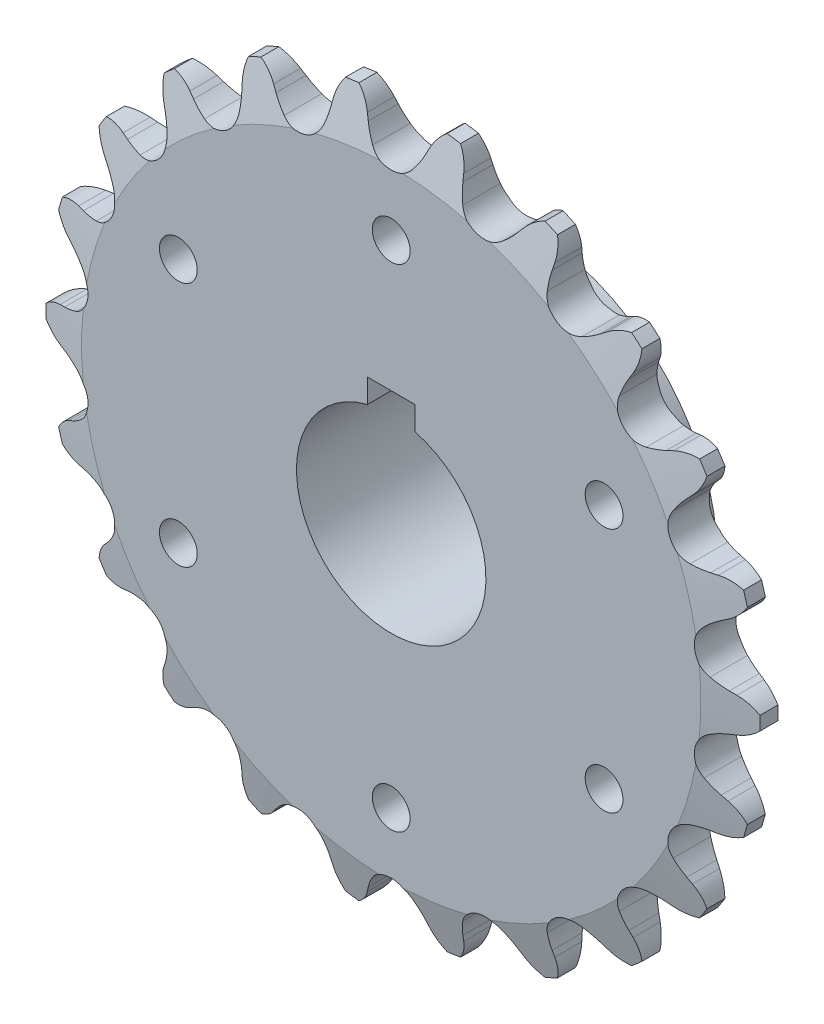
SolidWorks part; units mm, degrees
ref_plane "Front Plane" through (0, 0, 0) normal (0, 0, 1) x (1, 0, 0)
ref_plane "Top Plane" through (0, 0, 0) normal (0, 1, 0) x (1, 0, 0)
ref_plane "Right Plane" through (0, 0, 0) normal (1, 0, 0) x (0, 0, -1)
imported_body "Imported3"
sketch "Sketch1" plane through (0, 0, 0) normal (0, 0, -1) x (-1, 0, 0)
  circle A0 centre (0, 0) radius 12.7
extrude "Boss-Extrude1" add sketch "Sketch1" along normal blind 6.3817
sketch "Sketch2" plane through (0, 0, 2.794) normal (0, 0, 1) x (1, 0, 0)
  line L0 (1.59, 6.1608) -> (1.59, 7.7508)
  line L1 (1.59, 7.7508) -> (-1.59, 7.7508)
  line L2 (-1.59, 7.7508) -> (-1.59, 6.1608)
  arc A0 (-1.59, 6.1608) -> (1.59, 6.1608) centre (0, 0) cw
extrude "Cut-Extrude1" cut sketch "Sketch2" against normal through all
sketch "Sketch3" plane through (0, 0, 0) normal (0, 1, 0) x (1, 0, 0)
  line L0 (6.3627, 6.3818) -> (0, 6.3817)
  line L1 (0, 6.3817) -> (0, -2.794)
  line L2 (0, -2.794) -> (6.3627, -2.794)
  line L3 (6.3627, -2.794) -> (6.3627, 6.3818)
  line L4 (0, 6.3817) -> (0, -2.794) construction
revolve "Cut-Revolve1" cut sketch "Sketch3" angle 360 about L4
sketch "Sketch4" plane through (0, 0, 0) normal (0, 0, -1) x (-1, 0, 0)
  circle A0 centre (0, 16.51) radius 1.27
  circle A1 centre (14.2981, 8.255) radius 1.27
  circle A2 centre (14.2981, -8.255) radius 1.27
  circle A3 centre (0, -16.51) radius 1.27
  circle A4 centre (-14.2981, -8.255) radius 1.27
  circle A5 centre (-14.2981, 8.255) radius 1.27
  dimension "D1" = 2.54
  dimension "D2" = 16.51
  dimension "D3" = 6
extrude "Cut-Extrude2" cut sketch "Sketch4" against normal through all
